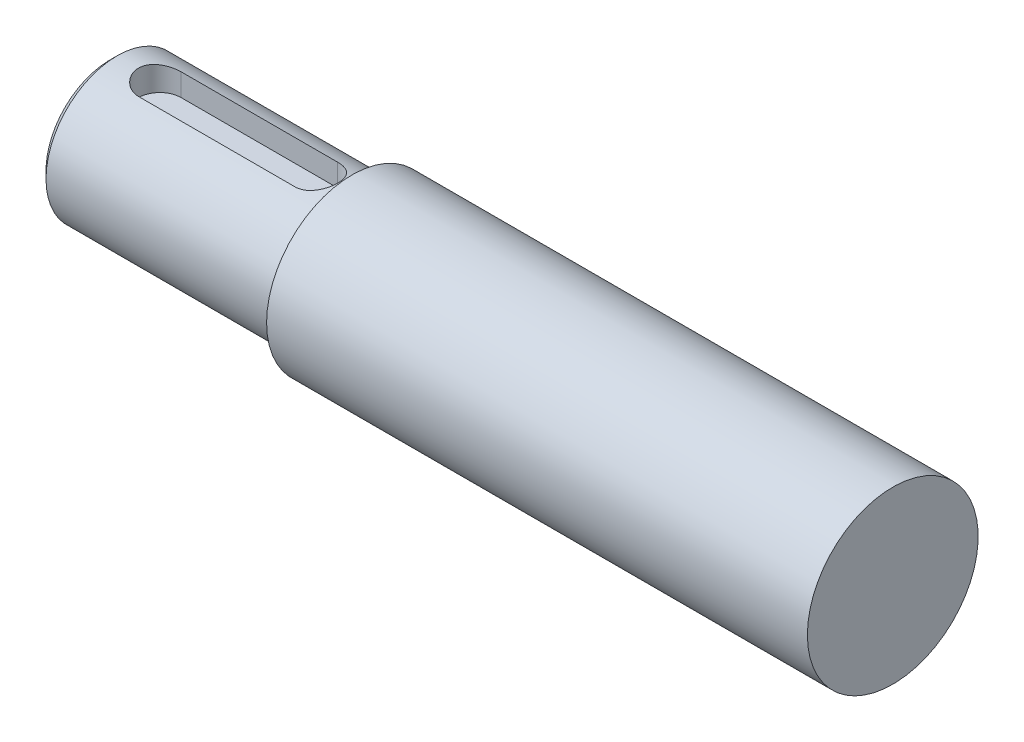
SolidWorks part; units mm, degrees
ref_plane "Plan de face" through (0, 0, 0) normal (0, 0, 1) x (1, 0, 0)
ref_plane "Plan de dessus" through (0, 0, 0) normal (0, 1, 0) x (1, 0, 0)
ref_plane "Plan de droite" through (0, 0, 0) normal (1, 0, 0) x (0, 0, -1)
sketch "Esquisse1" plane through (0, 0, 0) normal (0, 0, 1) x (1, 0, 0)
  line L0 (0, 0) -> (66.7811, 0) construction
  line L1 (0, 0) -> (0, 5)
  line L2 (0, 5) -> (17, 5)
  line L3 (17, 5) -> (17, 6)
  line L4 (17, 6) -> (55, 6)
  line L5 (55, 6) -> (55, 0)
  line L6 (0, 0) -> (55, 0)
  dimension "D1" = 17
  dimension "D2" = 55
  dimension "D3" = 5
  dimension "D4" = 6
revolve "Révolution1" add sketch "Esquisse1" angle 360 about L0
chamfer "Chanfrein1" distance 0.5 angle 45 1 edges at (0, 0, 5)
ref_plane "Plan1" through (0, 5, 0) normal (0, 1, 0) x (1, 0, 0)
sketch "Esquisse2" plane through (0, 5, 0) normal (0, 1, 0) x (1, 0, 0)
  line L0 (3.5, 1.5) -> (14.5, 1.5)
  line L1 (3.5, -1.5) -> (14.5, -1.5)
  line L2 (17, 6) -> (17, -6) construction
  arc A0 (3.5, 1.5) -> (3.5, -1.5) centre (3.5, 0) ccw
  arc A1 (14.5, -1.5) -> (14.5, 1.5) centre (14.5, 0) ccw
  dimension "D1" = 3
  dimension "D2" = 3
  dimension "D3" = 11
  dimension "D4" = 2.5
extrude "Enlèv. mat.-Extru.1" cut sketch "Esquisse2" against normal blind 1.8
sketch "Esquisse3" plane through (0, 0, 0) normal (-1, 0, 0) x (0, 0, 1)
  circle A0 centre (0, 0) radius 2
  dimension "D1" = 4
extrude "Enlèv. mat.-Extru.2" cut sketch "Esquisse3" against normal blind 10
